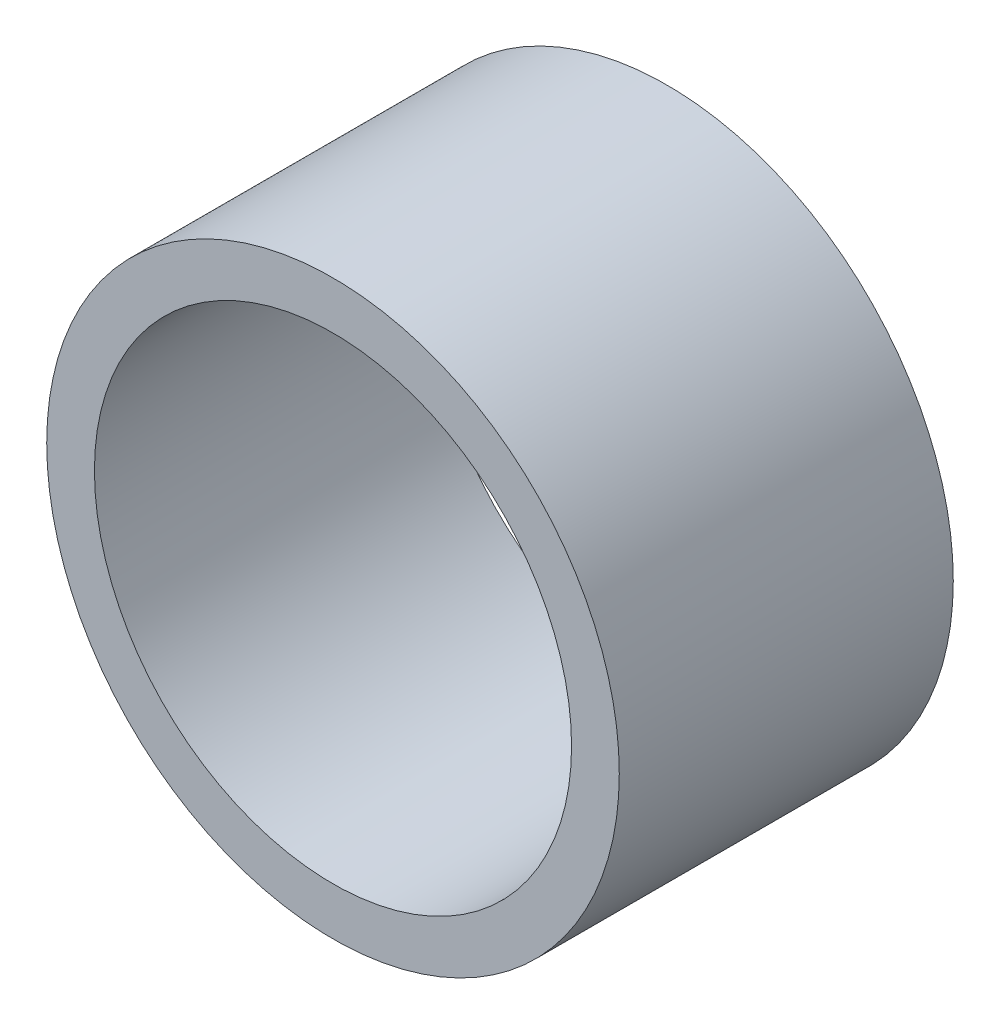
SolidWorks part; units mm, degrees
ref_plane "Plan de face" through (0, 0, 0) normal (0, 0, 1) x (1, 0, 0)
ref_plane "Plan de dessus" through (0, 0, 0) normal (0, 1, 0) x (1, 0, 0)
ref_plane "Plan de droite" through (0, 0, 0) normal (1, 0, 0) x (0, 0, -1)
sketch "Esquisse1" plane through (0, 0, 0) normal (0, 0, 1) x (1, 0, 0)
  circle A0 centre (0, 0) radius 12
  circle A1 centre (0, 0) radius 10
  dimension "D1" = 20
  dimension "D2" = 24
extrude "Extrusion1" add sketch "Esquisse1" along normal blind 14
